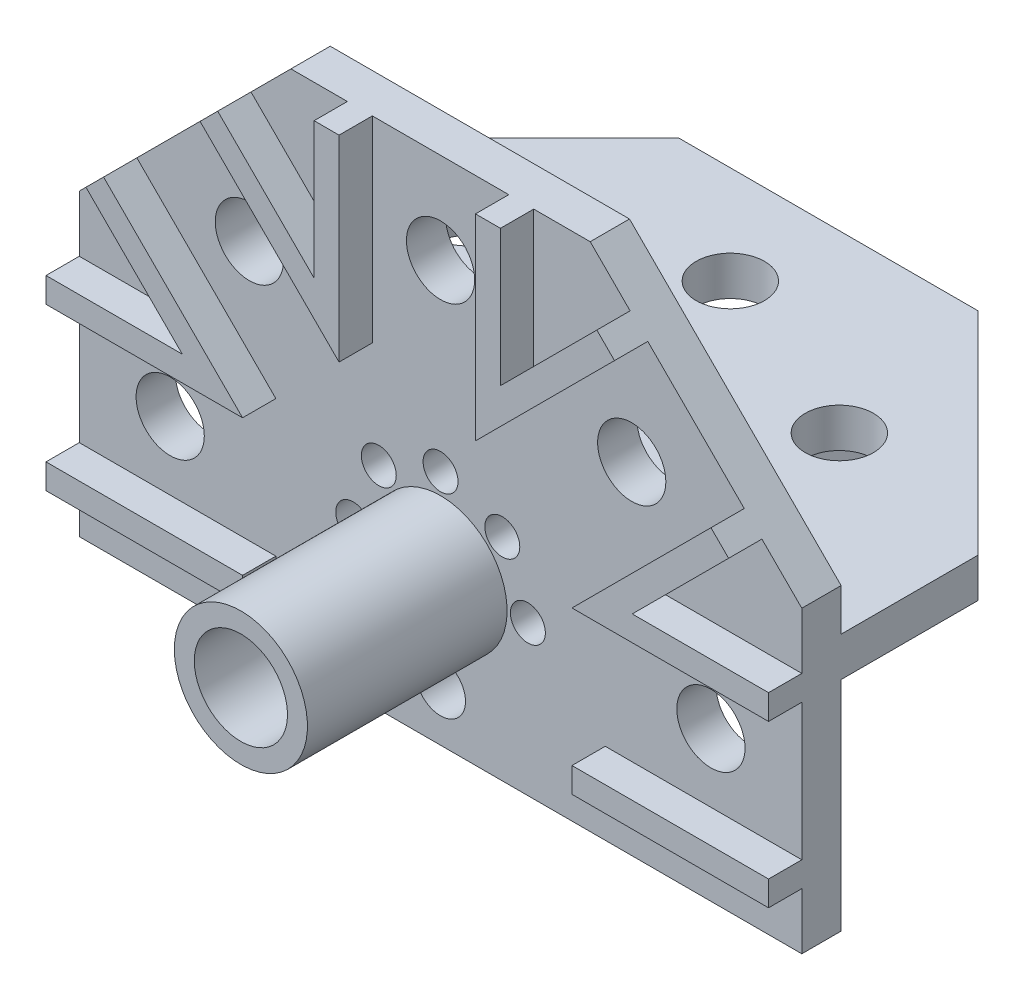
SolidWorks part; units mm, degrees
ref_plane "Front" through (0, 0, 0) normal (0, 0, 1) x (1, 0, 0)
ref_plane "Top" through (0, 0, 0) normal (0, 1, 0) x (1, 0, 0)
ref_plane "Right" through (0, 0, 0) normal (1, 0, 0) x (0, 0, -1)
sketch "Sketch1" plane through (0, 0, 0) normal (0, 0, 1) x (1, 0, 0)
  line L0 (-27.575, 0) -> (27.575, 0)
  line L1 (-27.575, 0) -> (-27.575, 22.8439)
  line L2 (-27.575, 22.8439) -> (-11.4219, 38.9969)
  line L3 (-11.4219, 38.9969) -> (11.4219, 38.9969)
  line L4 (11.4219, 38.9969) -> (27.575, 22.8439)
  line L5 (27.575, 22.8439) -> (27.575, 0)
  point P3 (0, 0)
  dimension "D1" = 55.15
  dimension "D2" = 135
extrude "Boss-Extrude1" add sketch "Sketch1" along normal blind 3
sketch "Sketch2" plane through (0, 0, 3) normal (0, 0, 1) x (1, 0, 0)
  line L0 (-27.575, 11.4219) -> (27.575, 11.4219) construction
  line L1 (-27.575, 22.8439) -> (-27.575, 0) construction
  line L2 (27.575, 0) -> (27.575, 22.8439) construction
  circle A0 centre (0, 11.4219) radius 3.556
  circle A1 centre (0, 11.4219) radius 5.08
  dimension "D1" = 10.16
  dimension "D2" = 7.112
extrude "Boss-Extrude2" add sketch "Sketch2" along normal blind 15.24
sketch "Sketch3" plane through (0, 0, 3) normal (0, 0, 1) x (1, 0, 0)
  line L0 (0, 11.4219) -> (27.575, 11.4219) construction
  line L1 (27.575, 0) -> (27.575, 22.8439) construction
  line L2 (-27.575, 0) -> (27.575, 0) construction
  circle A0 centre (6.6664, 11.4219) radius 1.3335
  circle A4 centre (-6.6664, 11.4219) radius 1.3335
  circle A5 centre (-4.7139, 16.1358) radius 1.3335
  circle A6 centre (0, 18.0884) radius 1.3335
  circle A7 centre (4.7139, 16.1358) radius 1.3335
  circle A14 centre (4.7139, 6.7081) radius 1.3335
  circle A15 centre (0, 4.7555) radius 1.3335
  circle A16 centre (-4.7139, 6.7081) radius 1.3335
  point P24 (0, 11.4219)
  dimension "D1" = 2.667
  dimension "D2" = 8
extrude "Cut-Extrude1" cut sketch "Sketch3" against normal blind 2.2
sketch "Sketch4" plane through (0, 0, 3) normal (0, 0, 1) x (1, 0, 0)
  line L0 (0, 11.4219) -> (27.575, 11.4219) construction
  line L1 (27.575, 0) -> (27.575, 22.8439) construction
  line L2 (-27.575, 0) -> (27.575, 0) construction
  circle A0 centre (20.6364, 11.4219) radius 2.6035
  circle A1 centre (6.6664, 11.4219) radius 1.3335 construction
  circle A2 centre (0, 3.8494) radius 1.905
  circle A4 centre (0, 11.4219) radius 3.556 construction
  circle A5 centre (0, 11.4219) radius 3.556 construction
  circle A8 centre (-20.6364, 11.4219) radius 2.6035
  circle A9 centre (-14.5922, 26.0141) radius 2.6035
  circle A10 centre (0, 32.0584) radius 2.6035
  circle A11 centre (14.5922, 26.0141) radius 2.6035
  circle A15 centre (14.5922, -3.1702) radius 2.6035
  circle A16 centre (0, -9.2145) radius 2.6035
  circle A17 centre (-14.5922, -3.1702) radius 2.6035
  dimension "D1" = 5.207
  dimension "D4" = 3.81
  dimension "D2" = 13.97
  dimension "D3" = 8
extrude "Cut-Extrude2" cut sketch "Sketch4" against normal blind 16.637
sketch "Sketch5" plane through (0, 0, 3) normal (0, 0, 1) x (1, 0, 0)
  line L0 (0, 11.4219) -> (0, 38.9969) construction
  line L1 (11.4219, 38.9969) -> (-11.4219, 38.9969) construction
  line L2 (0, 11.4219) -> (19.4985, 30.9204) construction
  line L3 (27.575, 22.8439) -> (11.4219, 38.9969) construction
  line L4 (5.207, 38.9969) -> (5.207, 23.9927)
  line L5 (5.207, 23.9927) -> (15.8166, 34.6023)
  line L6 (7.112, 38.9969) -> (7.112, 28.5918)
  line L7 (7.112, 28.5918) -> (14.4695, 35.9494)
  line L8 (7.112, 38.9969) -> (5.207, 38.9969)
  line L9 (14.4695, 35.9494) -> (15.8166, 34.6023)
  line L10 (27.575, 0) -> (27.575, 22.8439) construction
  line L11 (12.5708, 16.6289) -> (27.575, 16.6289)
  line L12 (23.1804, 27.2385) -> (12.5708, 16.6289)
  line L13 (24.5274, 25.8915) -> (17.1699, 18.5339)
  line L14 (17.1699, 18.5339) -> (27.575, 18.5339)
  line L15 (27.575, 18.5339) -> (27.575, 16.6289)
  line L16 (24.5274, 25.8915) -> (23.1804, 27.2385)
  line L17 (-12.5708, 6.2149) -> (-12.5708, 4.3099)
  line L18 (27.575, 6.2149) -> (12.5708, 6.2149)
  line L19 (27.575, 4.3099) -> (17.1699, 4.3099)
  line L20 (-12.5708, 4.3099) -> (-17.1699, 4.3099)
  line L21 (12.5708, 6.2149) -> (12.5708, 4.3099)
  line L22 (27.575, 4.3099) -> (27.575, 6.2149)
  line L23 (12.5708, 4.3099) -> (17.1699, 4.3099)
  line L35 (-12.5708, 6.2149) -> (-27.575, 6.2149)
  line L38 (-17.1699, 4.3099) -> (-27.575, 4.3099)
  line L39 (-27.575, 4.3099) -> (-27.575, 6.2149)
  line L41 (-12.5708, 16.6289) -> (-23.1804, 27.2385)
  line L42 (-27.575, 16.6289) -> (-12.5708, 16.6289)
  line L43 (-27.575, 18.5339) -> (-17.1699, 18.5339)
  line L44 (-17.1699, 18.5339) -> (-24.5274, 25.8915)
  line L45 (-24.5274, 25.8915) -> (-23.1804, 27.2385)
  line L46 (-27.575, 18.5339) -> (-27.575, 16.6289)
  line L47 (-5.207, 23.9927) -> (-5.207, 38.9969)
  line L48 (-15.8166, 34.6023) -> (-5.207, 23.9927)
  line L49 (-14.4695, 35.9494) -> (-7.112, 28.5918)
  line L50 (-7.112, 28.5918) -> (-7.112, 38.9969)
  line L51 (-7.112, 38.9969) -> (-5.207, 38.9969)
  line L52 (-14.4695, 35.9494) -> (-15.8166, 34.6023)
  line L94 (12.5708, 6.2149) -> (23.1804, -4.3946)
  line L95 (17.1699, 4.3099) -> (24.5274, -3.0476)
  line L96 (24.5274, -3.0476) -> (23.1804, -4.3946)
  line L97 (5.207, -1.1489) -> (5.207, -16.1531)
  line L98 (15.8166, -11.7584) -> (5.207, -1.1489)
  line L99 (14.4695, -13.1055) -> (7.112, -5.7479)
  line L100 (7.112, -5.7479) -> (7.112, -16.1531)
  line L101 (7.112, -16.1531) -> (5.207, -16.1531)
  line L102 (14.4695, -13.1055) -> (15.8166, -11.7584)
  line L103 (-5.207, -1.1489) -> (-15.8166, -11.7584)
  line L104 (-5.207, -16.1531) -> (-5.207, -1.1489)
  line L105 (-7.112, -16.1531) -> (-7.112, -5.7479)
  line L106 (-7.112, -5.7479) -> (-14.4695, -13.1055)
  line L107 (-14.4695, -13.1055) -> (-15.8166, -11.7584)
  line L108 (-7.112, -16.1531) -> (-5.207, -16.1531)
  line L109 (-23.1804, -4.3946) -> (-12.5708, 6.2149)
  line L110 (-24.5274, -3.0476) -> (-17.1699, 4.3099)
  line L111 (-24.5274, -3.0476) -> (-23.1804, -4.3946)
  circle A0 centre (0, 11.4219) radius 3.556 construction
  circle A1 centre (0, 11.4219) radius 3.556 construction
  point P63 (0, 11.4219)
  dimension "D1" = 5.207
  dimension "D2" = 1.905
  dimension "D3" = 8
extrude "Boss-Extrude3" add sketch "Sketch5" along normal blind 2.54
sketch "Sketch6" plane through (0, 0, 0) normal (0, 0, -1) x (-1, 0, 0)
  line L0 (-27.575, 0) -> (-27.575, 22.8439) construction
  line L1 (-27.575, 16.6289) -> (27.575, 16.6289)
  line L2 (-27.575, 16.6289) -> (-27.575, 19.6289)
  line L3 (-27.575, 19.6289) -> (27.575, 19.6289)
  line L4 (27.575, 16.6289) -> (27.575, 19.6289)
  line L5 (27.575, 22.8439) -> (27.575, 0) construction
  dimension "D1" = 3
extrude "Boss-Extrude4" add sketch "Sketch6" along normal blind 26.6
sketch "Sketch7" plane through (0, 16.6289, 0) normal (0, -1, 0) x (1, 0, 0)
  line L0 (0, 28.55) -> (0, -26.6) construction
  line L1 (-27.575, -10.4469) -> (-27.575, -26.6)
  line L2 (-11.4219, -26.6) -> (11.4219, -26.6)
  line L3 (11.4219, -26.6) -> (27.575, -10.4469)
  line L4 (-27.575, -26.6) -> (27.575, -26.6) construction
  line L5 (27.575, -26.6) -> (27.575, 28.55) construction
  line L6 (27.575, 28.55) -> (-27.575, 28.55) construction
  line L7 (-27.575, 28.55) -> (-27.575, -26.6) construction
  line L8 (27.575, -10.4469) -> (27.575, 12.3969)
  line L9 (27.575, 12.3969) -> (11.4219, 28.55)
  line L10 (11.4219, 28.55) -> (-11.4219, 28.55)
  line L11 (-11.4219, 28.55) -> (-27.575, 12.3969)
  line L12 (-27.575, 12.3969) -> (-27.575, -10.4469)
  line L13 (-27.575, -10.4469) -> (-11.4219, -26.6)
  line L14 (-27.575, -26.6) -> (-11.4219, -26.6)
  line L15 (11.4219, -26.6) -> (27.575, -26.6)
  line L16 (27.575, -26.6) -> (27.575, -10.4469)
  circle A0 centre (0, 0.975) radius 27.575 construction
extrude "Cut-Extrude3" cut sketch "Sketch7" against normal through all contours L13 M5 M6 | L3 M6 M7
sketch "Sketch8" plane through (0, 16.6289, 0) normal (0, -1, 0) x (1, 0, 0)
  line L0 (11.4219, -26.6) -> (-11.4219, -26.6) construction
  line L1 (11.4219, -26.6) -> (27.575, -10.4469) construction
  line L2 (27.575, -10.4469) -> (27.575, 12.3969) construction
  line L3 (27.575, 12.3969) -> (11.4219, 28.55) construction
  line L4 (11.4219, 28.55) -> (-11.4219, 28.55) construction
  line L5 (-11.4219, 28.55) -> (-27.575, 12.3969) construction
  line L6 (-27.575, 12.3969) -> (-27.575, -10.4469) construction
  line L7 (-27.575, -10.4469) -> (-11.4219, -26.6) construction
  line L8 (-11.4219, -26.6) -> (11.4219, -26.6) construction
  line L9 (0, 0.975) -> (0, -26.6) construction
  circle A0 centre (0, 0.975) radius 27.575 construction
  circle A1 centre (0, -5.1463) radius 1.3335
  circle A2 centre (0, -19.1163) radius 2.6035
  circle A3 centre (-4.3284, -3.3534) radius 1.3335
  circle A4 centre (-14.2067, -13.2317) radius 2.6035
  circle A15 centre (4.3284, -3.3534) radius 1.3335
  circle A16 centre (14.2067, -13.2317) radius 2.6035
  circle A17 centre (14.2067, 15.1817) radius 2.6035
  circle A18 centre (20.0913, 0.975) radius 2.6035
  circle A19 centre (-14.2067, 15.1817) radius 2.6035
  circle A20 centre (0, 21.0663) radius 2.6035
  circle A21 centre (0, 7.0963) radius 1.3335
  circle A22 centre (4.3284, 5.3034) radius 1.3335
  circle A23 centre (6.1213, 0.975) radius 1.3335
  circle A24 centre (-6.1213, 0.975) radius 1.3335
  circle A25 centre (-4.3284, 5.3034) radius 1.3335
  circle A26 centre (-20.0913, 0.975) radius 2.6035
  point P49 (0, 0.975)
  dimension "D2" = 5.207
  dimension "D3" = 2.667
  dimension "D1" = 13.97
  dimension "D4" = 8
extrude "Cut-Extrude4" cut sketch "Sketch8" against normal through all contours A4 | A2 | A16
sketch "Sketch9" plane through (0, 16.6289, 0) normal (0, -1, 0) x (1, 0, 0)
  line L0 (0, -19.1163) -> (0, 49980.8837) construction
  line L1 (14.2067, -13.2317) -> (35369.5458, -35368.5708) construction
  line L2 (11.4219, -26.6) -> (27.575, -10.4469) construction
  line L3 (5.207, -26.6) -> (5.207, -11.5958)
  line L4 (11.4219, -26.6) -> (-11.4219, -26.6) construction
  line L5 (5.207, -11.5958) -> (15.8166, -22.2054)
  line L6 (6.957, -26.6) -> (6.957, -15.8207)
  line L7 (6.957, -15.8207) -> (14.5791, -23.4428)
  line L8 (5.207, -26.6) -> (6.957, -26.6)
  line L9 (14.5791, -23.4428) -> (15.8166, -22.2054)
  line L10 (0, 0.975) -> (0.41, 1.226) construction
  line L11 (-14.5791, -23.4428) -> (-6.957, -15.8207)
  line L12 (-15.8166, -22.2054) -> (-5.207, -11.5958)
  line L13 (-6.957, -15.8207) -> (-6.957, -26.6)
  line L14 (-5.207, -11.5958) -> (-5.207, -26.6)
  line L15 (-6.957, -26.6) -> (-5.207, -26.6)
  line L16 (-15.8166, -22.2054) -> (-14.5791, -23.4428)
  line L17 (-12.5708, -4.232) -> (-13.8082, -2.9946)
  line L18 (-13.8082, -2.9946) -> (-16.7957, -5.982)
  line L19 (-16.7957, -5.982) -> (-24.4178, -13.6041)
  line L20 (-12.5708, -4.232) -> (-23.1804, -14.8416)
  line L21 (-24.4178, -13.6041) -> (-23.1804, -14.8416)
  line L22 (12.5708, -4.232) -> (13.8082, -2.9946)
  line L23 (13.8082, -2.9946) -> (16.7957, -5.982)
  line L47 (24.4178, -13.6041) -> (16.7957, -5.982)
  line L48 (23.1804, -14.8416) -> (12.5708, -4.232)
  line L52 (23.1804, -14.8416) -> (24.4178, -13.6041)
  line L53 (16.7957, -5.982) -> (27.575, -5.982)
  line L54 (12.5708, -4.232) -> (27.575, -4.232)
  line L55 (27.575, -5.982) -> (27.575, -4.232)
  line L56 (14.5791, 25.3928) -> (6.957, 17.7707)
  line L57 (15.8166, 24.1554) -> (5.207, 13.5458)
  line L58 (6.957, 17.7707) -> (6.957, 28.55)
  line L59 (5.207, 13.5458) -> (5.207, 28.55)
  line L60 (6.957, 28.55) -> (5.207, 28.55)
  line L61 (15.8166, 24.1554) -> (14.5791, 25.3928)
  line L62 (27.575, 7.932) -> (16.7957, 7.932)
  line L63 (27.575, 6.182) -> (12.5708, 6.182)
  line L64 (16.7957, 7.932) -> (24.4178, 15.5541)
  line L65 (12.5708, 6.182) -> (23.1804, 16.7916)
  line L66 (24.4178, 15.5541) -> (23.1804, 16.7916)
  line L67 (27.575, 6.182) -> (27.575, 7.932)
  line L68 (-6.957, 28.55) -> (-6.957, 17.7707)
  line L69 (-5.207, 28.55) -> (-5.207, 13.5458)
  line L70 (-6.957, 17.7707) -> (-14.5791, 25.3928)
  line L71 (-5.207, 13.5458) -> (-15.8166, 24.1554)
  line L72 (-5.207, 28.55) -> (-6.957, 28.55)
  line L73 (-14.5791, 25.3928) -> (-15.8166, 24.1554)
  line L74 (-24.4178, 15.5541) -> (-16.7957, 7.932)
  line L75 (-23.1804, 16.7916) -> (-12.5708, 6.182)
  line L76 (-16.7957, 7.932) -> (-27.575, 7.932)
  line L77 (-12.5708, 6.182) -> (-27.575, 6.182)
  line L78 (-27.575, 7.932) -> (-27.575, 6.182)
  line L79 (-23.1804, 16.7916) -> (-24.4178, 15.5541)
  line L80 (-27.575, -5.982) -> (-16.7957, -5.982)
  line L81 (-27.575, -4.232) -> (-12.5708, -4.232)
  line L82 (-27.575, -4.232) -> (-27.575, -5.982)
  point P8 (19.4985, -18.5235)
  point P64 (0, 0.975)
  dimension "D1" = 5.207
  dimension "D2" = 5.207
  dimension "D3" = 1.75
  dimension "D4" = 8
extrude "Boss-Extrude5" add sketch "Sketch9" along normal blind 2.54
sketch "Sketch10" plane through (0, 16.6289, 0) normal (0, -1, 0) x (1, 0, 0)
  line L0 (0, -19.1163) -> (0, 49980.8837) construction
  line L1 (14.2067, -13.2317) -> (35369.5458, -35368.5708) construction
  line L2 (15.8166, -22.2054) -> (23.1804, -14.8416) construction
  line L3 (0, 0.9678) -> (1.3463, 1.5168) construction
  circle A0 centre (0, -5.1463) radius 1.275
  circle A1 centre (0, -19.1163) radius 2.6035 construction
  circle A2 centre (-4.3233, -3.3556) radius 1.275
  circle A8 centre (4.3233, -3.3556) radius 1.275
  circle A9 centre (4.3233, 5.2911) radius 1.275
  circle A10 centre (6.1141, 0.9678) radius 1.275
  circle A11 centre (0, 7.0819) radius 1.275
  circle A12 centre (-4.3233, 5.2911) radius 1.275
  circle A13 centre (-6.1141, 0.9678) radius 1.275
  point P8 (19.4985, -18.5235)
  point P32 (0, 0.9678)
  dimension "D1" = 2.55
  dimension "D2" = 13.97
  dimension "D3" = 8
extrude "Cut-Extrude5" cut sketch "Sketch10" against normal blind 2.5
